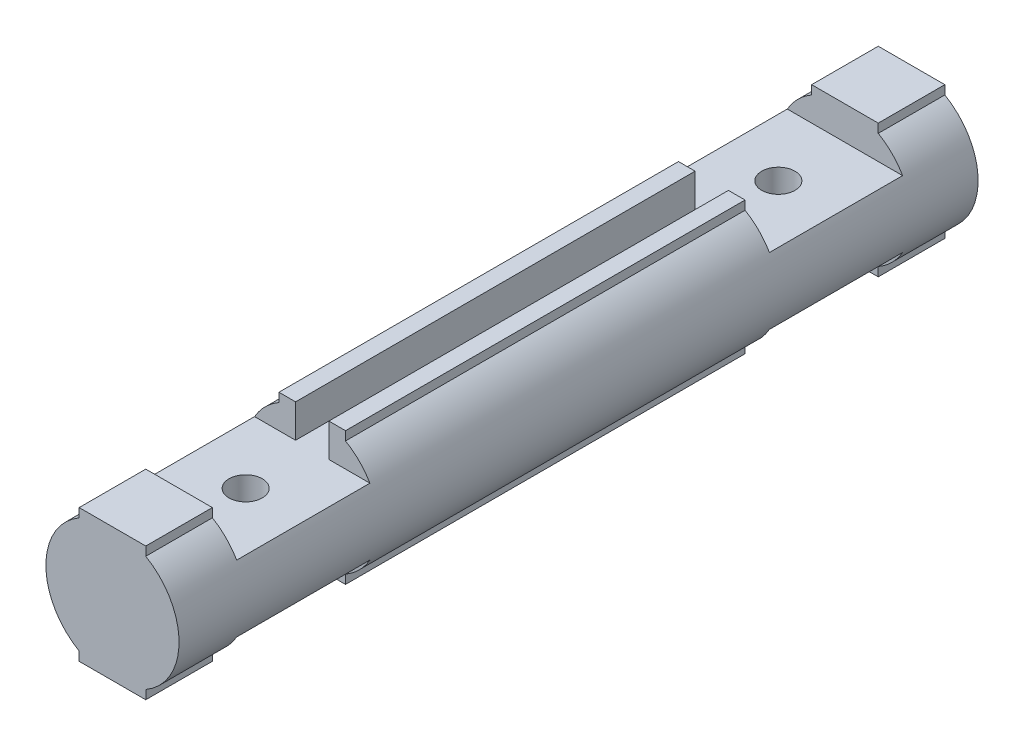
SolidWorks part; units mm, degrees
ref_plane "Front Plane" through (0, 0, 0) normal (0, 0, 1) x (1, 0, 0)
ref_plane "Top Plane" through (0, 0, 0) normal (0, 1, 0) x (1, 0, 0)
ref_plane "Right Plane" through (0, 0, 0) normal (1, 0, 0) x (0, 0, -1)
sketch "Sketch1" plane through (0, 0, 0) normal (0, 0, 1) x (1, 0, 0)
  circle A0 centre (0, 0) radius 10
  dimension "D1" = 20
extrude "Boss-Extrude1" add sketch "Sketch1" along normal mid plane 120
sketch "Sketch2" plane through (0, 0, 60) normal (0, 0, 1) x (1, 0, 0)
  line L1 (5, -10) -> (-5, -10)
  line L2 (5, -10) -> (5, 10)
  line L3 (5, 10) -> (-5, 10)
  line L4 (-5, -10) -> (-5, 10)
  line L5 (5, -10) -> (-5, 10) construction
  line L6 (5, 10) -> (-5, -10) construction
  circle A0 centre (0, 0) radius 10 construction
  point P0 (0, 0)
  dimension "D2" = 10
extrude "Boss-Extrude2" add sketch "Sketch2" against normal up to surface (120 mm away)
ref_plane "Plane1" through (0, 0, -40) normal (0, 0, -1) x (-1, 0, 0)
sketch "Sketch3" plane through (0, 0, -40) normal (0, 0, 1) x (1, 0, 0)
  line L1 (8.6603, 5) -> (-8.6603, 5)
  line L2 (8.6603, 5) -> (8.6603, 10)
  line L3 (8.6603, 10) -> (-8.6603, 10)
  line L4 (-8.6603, 5) -> (-8.6603, 10)
  line L5 (8.6603, 5) -> (-8.6603, 10) construction
  line L6 (8.6603, 10) -> (-8.6603, 5) construction
  circle A0 centre (0, 0) radius 10 construction
  point P0 (0, 7.5)
  dimension "D1" = 5
extrude "Cut-Extrude1" cut sketch "Sketch3" against normal mid plane 20
sketch "Sketch4" plane through (0, 5, 0) normal (0, 1, 0) x (1, 0, 0)
  line L0 (-8.6603, 50) -> (8.6603, 30) construction
  circle A0 centre (0, 40) radius 2.5
  dimension "D1" = 5
extrude "Cut-Extrude3" cut sketch "Sketch4" against normal through all
mirror "Mirror1" about plane through (0, 0, 0) normal (0, 0, 1) of "Cut-Extrude3", "Cut-Extrude1"
sketch "Sketch5" plane through (0, 10, 0) normal (0, 1, 0) x (1, 0, 0)
  line L0 (-8.6603, 30) -> (8.6603, 30) construction
  line L1 (2.5, -30) -> (-2.5, -30)
  line L2 (2.5, -30) -> (2.5, 30)
  line L3 (2.5, 30) -> (-2.5, 30)
  line L4 (-2.5, -30) -> (-2.5, 30)
  line L5 (2.5, -30) -> (-2.5, 30) construction
  line L6 (2.5, 30) -> (-2.5, -30) construction
  point P0 (0, 0)
  dimension "D1" = 5
extrude "Cut-Extrude2" cut sketch "Sketch5" against normal up to surface (5 mm away)
mirror "Mirror2" about plane through (0, 0, 0) normal (0, 1, 0) of "Mirror1", "Cut-Extrude1", "Cut-Extrude2"
